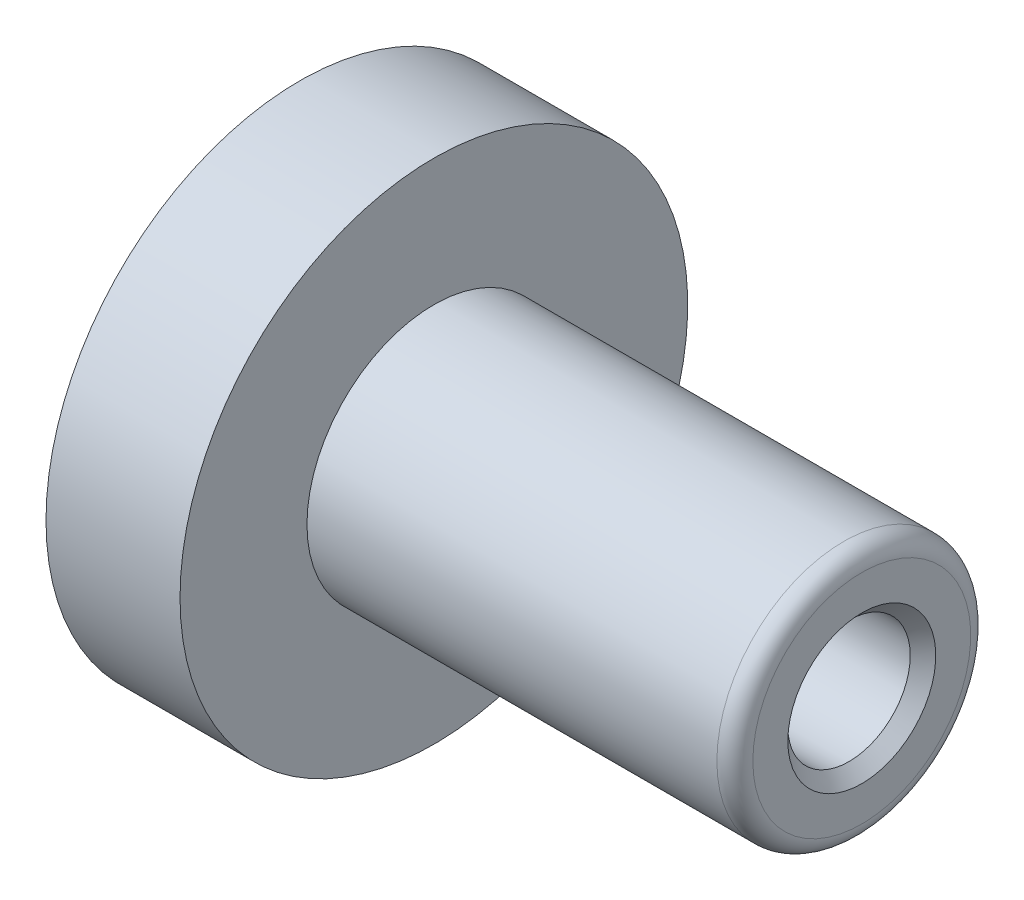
SolidWorks part; units mm, degrees
ref_plane "Front Plane" through (0, 0, 0) normal (0, 0, 1) x (1, 0, 0)
ref_plane "Top Plane" through (0, 0, 0) normal (0, 1, 0) x (1, 0, 0)
ref_plane "Right Plane" through (0, 0, 0) normal (1, 0, 0) x (0, 0, -1)
sketch "Sketch1" plane through (0, 0, 0) normal (0, 0, 1) x (1, 0, 0)
  line L0 (0, 0) -> (102.3864, 0) construction
  line L1 (0, 8.128) -> (0, 22.225)
  line L2 (0, 22.225) -> (11.7348, 22.225)
  line L3 (11.7348, 22.225) -> (11.7348, 11.1125)
  line L4 (11.7348, 11.1125) -> (47.625, 11.1125)
  line L5 (49.1998, 9.5377) -> (49.1998, 0)
  line L6 (49.1998, 0) -> (28.067, 0)
  line L7 (0, 8.128) -> (28.067, 8.128)
  line L8 (28.067, 8.128) -> (28.067, 0)
  arc A0 (49.1998, 9.5377) -> (47.625, 11.1125) centre (47.625, 9.5377) ccw
  dimension "D5" = 1.5748
  dimension "D1" = 11.7348
  dimension "D2" = 44.45
  dimension "D3" = 28.067
  dimension "D4" = 16.256
  dimension "D6" = 49.1998
  dimension "D7" = 22.225
revolve "Revolve1" add sketch "Sketch1" angle 360 about L0
sketch "Sketch2" plane through (0, 0, 0) normal (-1, 0, 0) x (0, 0, 1)
  line L0 (0, 0) -> (9.7644, 0) construction
  circle A0 centre (0, 12.7) radius 3.2004
  circle A1 centre (0, -12.7) radius 3.2004
  dimension "D2" = 6.4008
  dimension "D1" = 25.4
extrude "Cut-Extrude1" cut sketch "Sketch2" against normal blind 7.9502
sketch "Sketch3" plane through (49.1998, 0, 0) normal (1, 0, 0) x (0, 0, -1)
  circle A0 centre (0, 0) radius 5.3594
  dimension "D1" = 10.7188
extrude "Cut-Extrude2" cut sketch "Sketch3" against normal blind 18.5674
chamfer "Chamfer1" distance 1.1176 angle 45 1 edges at (49.1998, 0, -5.3594)
